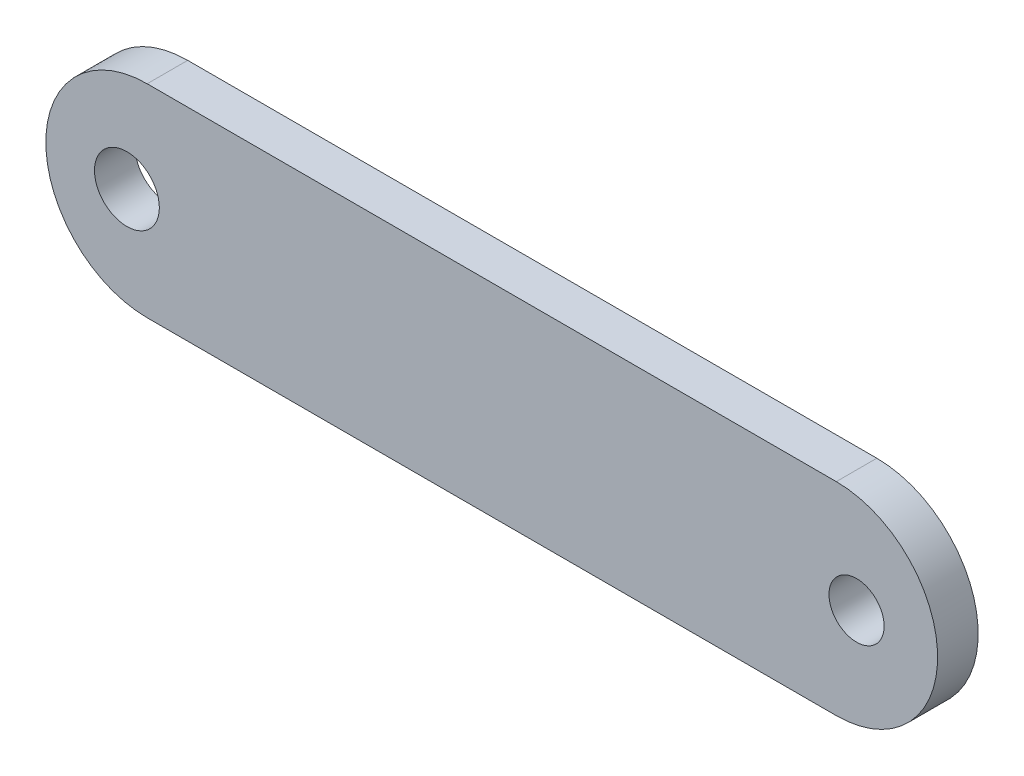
SolidWorks part; units mm, degrees
ref_plane "Plan de face" through (0, 0, 0) normal (0, 0, 1) x (1, 0, 0)
ref_plane "Plan de dessus" through (0, 0, 0) normal (0, 1, 0) x (1, 0, 0)
ref_plane "Plan de droite" through (0, 0, 0) normal (1, 0, 0) x (0, 0, -1)
sketch "Esquisse1" plane through (0, 0, 0) normal (0, 0, 1) x (1, 0, 0)
  line L0 (-42.5, 0) -> (42.5, 0) construction
  line L1 (-42.5, 12.5) -> (42.5, 12.5)
  line L2 (-42.5, -12.5) -> (42.5, -12.5)
  arc A0 (-42.5, 12.5) -> (-42.5, -12.5) centre (-42.5, 0) ccw
  arc A1 (42.5, -12.5) -> (42.5, 12.5) centre (42.5, 0) ccw
  point P2 (0, 0)
  dimension "D2" = 110
  dimension "D1" = 25
extrude "Boss.-Extru.1" add sketch "Esquisse1" along normal mid plane 5
sketch "Esquisse2" plane through (0, 0, 2.5) normal (0, 0, 1) x (1, 0, 0)
  circle A0 centre (-45, 0) radius 4
  dimension "D1" = 8
  dimension "D2" = 45
extrude "Enlèv. mat.-Extru.1" cut sketch "Esquisse2" against normal through all
hole_wizard "Trou taraudé M81" positions "Esquisse4" profile "Esquisse3" tap size "M8" standard "ISO"
sketch "Esquisse4" plane through (0, 0, 2.5) normal (0, 0, 1) x (1, 0, 0)
  point P0 (45, 0)
  dimension "D1" = 45
sketch "Esquisse3" plane through (45, 0, 2.5) normal (1, 0, 0) x (0, -1, 0)
  line L0 (0, 0) -> (0, 5)
  line L1 (0, 5) -> (3.4, 5)
  line L2 (3.4, 5) -> (3.4, 0)
  line L5 (3.4, 0) -> (0, 0)
  line L11 (0, -6.35) -> (0, 107.95) construction
  dimension "Diamètre du trou pour taraudage jusqu'au prochain" = 6.8
  dimension "Profondeur du trou pour taraudage jusqu'au prochain" = 5
